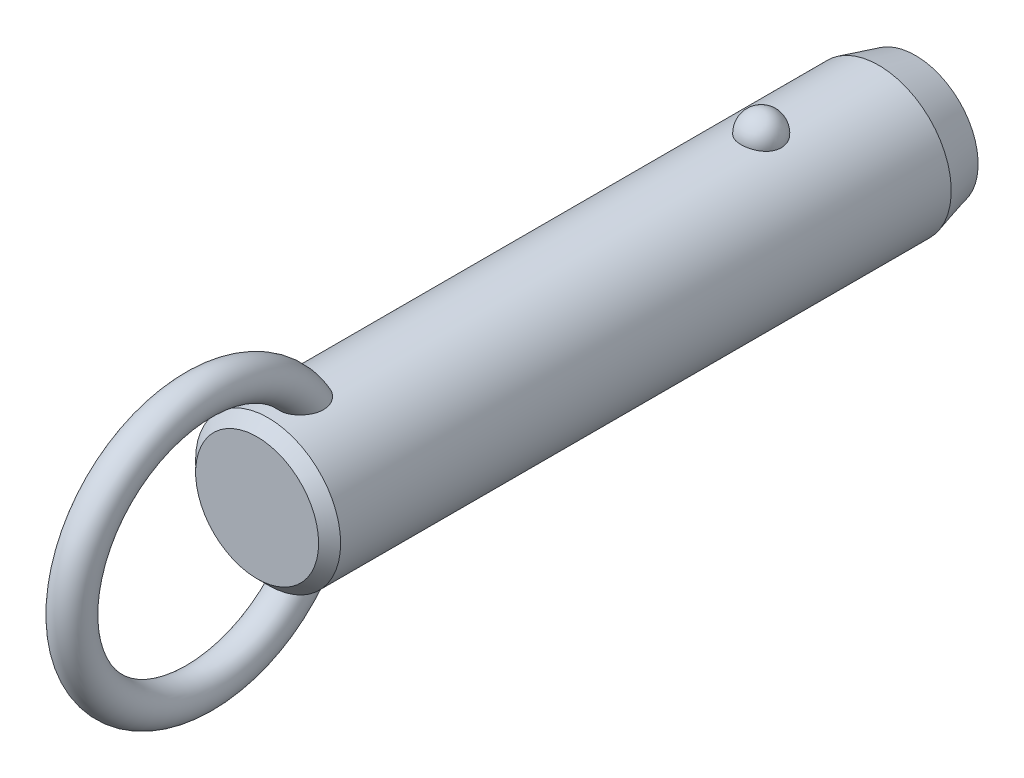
SolidWorks part; units mm, degrees
ref_plane "Front Plane" through (0, 0, 0) normal (0, 0, 1) x (1, 0, 0)
ref_plane "Top Plane" through (0, 0, 0) normal (0, 1, 0) x (1, 0, 0)
ref_plane "Right Plane" through (0, 0, 0) normal (1, 0, 0) x (0, 0, -1)
sketch "Sketch2" plane through (0, 0, 0) normal (0, 0, 1) x (1, 0, 0)
  circle A0 centre (0, 0) radius 7.9
  point P3 (0, 7.9)
  dimension "D1" = 15.8
extrude "Boss-Extrude1" add sketch "Sketch2" along normal blind 43.2
sketch "Sketch3" plane through (0, 0, 0) normal (0, 0, -1) x (-1, 0, 0)
  circle A0 centre (0, 0) radius 7.9
  dimension "D1" = 15.8
extrude "Boss-Extrude2" add sketch "Sketch3" along normal blind 19
chamfer "Chamfer1" distance 4 angle 15 1 edges at (-7.9, 0, -19)
sketch "Sketch12" plane through (0, 0, 0) normal (1, 0, 0) x (0, 0, -1)
  line L0 (-43.2, 7.9) -> (-43.2, -7.9) construction
  point P0 (-43.2, 0)
sketch "Sketch13" plane through (0, 0, 0) normal (1, 0, 0) x (0, 0, -1)
  circle A0 centre (-59.05, 0) radius 15.85
  point P2 (-43.2, 0)
  dimension "D1" = 31.7
sketch "Sketch14" plane through (0, 0, 0) normal (0, 1, 0) x (1, 0, 0)
  circle A0 centre (0, -45.2) radius 2
  point P2 (0, -43.2)
  dimension "D1" = 4
sweep "Sweep1" add profiles "Sketch14" path "Sketch13"
sketch "Sketch15" plane through (0, 0, 43.2) normal (0, 0, 1) x (1, 0, 0)
  circle A0 centre (0, 0) radius 7.9
  dimension "D1" = 15.8
extrude "Boss-Extrude3" add sketch "Sketch15" along normal blind 9.52
chamfer "Chamfer2" distance 1.2 angle 45 1 edges at (7.9, 0, 52.72)
sketch "Sketch18" plane through (0, 0, 0) normal (1, 0, 0) x (0, 0, -1)
  line L0 (15, 7.9) -> (-45.3091, 7.9) construction
  line L1 (2.2, 10.1) -> (2.2, 5.7)
  line L2 (-45.3091, -7.9) -> (15, -7.9) construction
  arc A0 (2.2, 10.1) -> (2.2, 5.7) centre (2.2, 7.9) ccw
  point P4 (0, 7.9)
  dimension "D1" = 18
revolve "Revolve1" add sketch "Sketch18" angle 360 about L1
